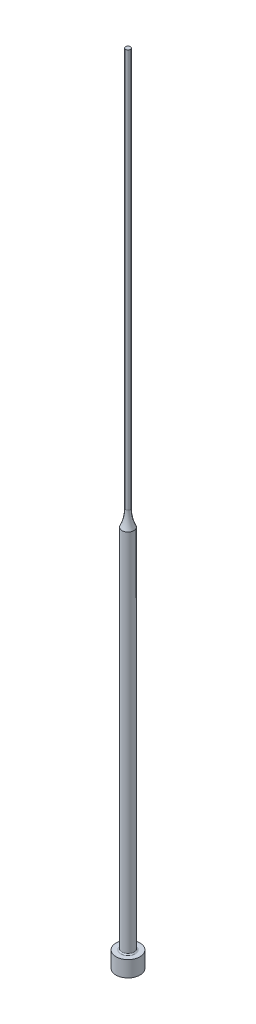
SolidWorks part; units mm, degrees
ref_plane "Front Plane" through (0, 0, 0) normal (0, 0, 1) x (1, 0, 0)
ref_plane "Top Plane" through (0, 0, 0) normal (0, 1, 0) x (1, 0, 0)
ref_plane "Right Plane" through (0, 0, 0) normal (1, 0, 0) x (0, 0, -1)
sketch "Sketch1" plane through (0, 0, 0) normal (0, 0, 1) x (1, 0, 0)
  line L0 (0, 0) -> (3, 0)
  line L1 (55, 0) -> (-55, 0) construction
  line L2 (3, 0) -> (3, 4)
  line L3 (3, 4) -> (1.8, 4)
  line L4 (1.5, 4.3) -> (1.5, 95.8539)
  line L6 (0.6, 100) -> (0.6, 200)
  line L7 (0.6, 200) -> (0, 200)
  line L8 (0, 200) -> (0, 0)
  arc A0 (0.6, 100) -> (1.5, 95.8539) centre (10.6, 100) ccw
  arc A1 (1.8, 4) -> (1.5, 4.3) centre (1.8, 4.3) cw
  dimension "D7" = 100
  dimension "D8" = 0.3
  dimension "D5" = 10
  dimension "D1" = 0.6
  dimension "D2" = 1.5
  dimension "D3" = 3
  dimension "D4" = 4
  dimension "D6" = 200
revolve "Revolve1" add sketch "Sketch1" angle 360 about L8
